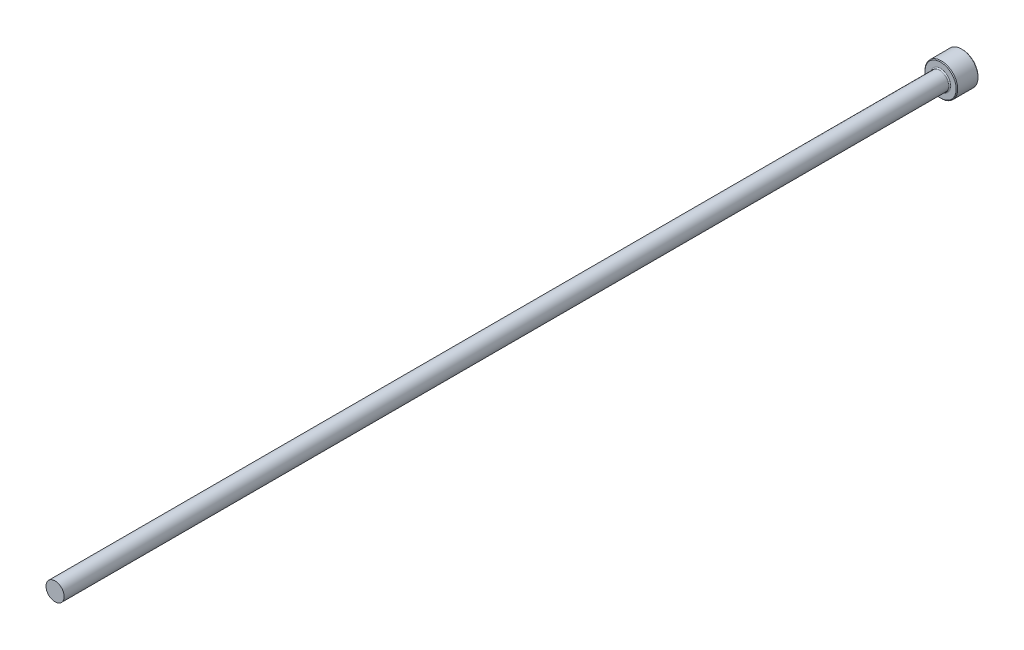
SolidWorks part; units mm, degrees
ref_plane "Front Plane" through (0, 0, 0) normal (0, 0, 1) x (1, 0, 0)
ref_plane "Top Plane" through (0, 0, 0) normal (0, 1, 0) x (1, 0, 0)
ref_plane "Right Plane" through (0, 0, 0) normal (1, 0, 0) x (0, 0, -1)
sketch "Sketch1" plane through (0, 0, 0) normal (1, 0, 0) x (0, 0, -1)
  line L0 (0, 0) -> (0, 4.5)
  line L1 (0, 4.95) -> (0, -4.95) construction
  line L2 (0, 4.5) -> (-6, 4.5)
  line L3 (-6, 4.5) -> (-6, 2.8)
  line L4 (-6.3, 2.5) -> (-250, 2.5)
  line L5 (-250, 2.5) -> (-250, 0)
  line L6 (4.95, 0) -> (-4.95, 0) construction
  line L7 (-250, 0) -> (0, 0)
  line L8 (-109.0506, 0) -> (16.9928, 0) construction
  arc A0 (-6, 2.8) -> (-6.3, 2.5) centre (-6.3, 2.8) cw
  dimension "D1" = 0.3
  dimension "D2" = 9
  dimension "D3" = 5
  dimension "D4" = 250
  dimension "D5" = 6
revolve "Revolve1" add sketch "Sketch1" angle 360 about L8
chamfer "Chamfer1" distance 0.2 angle 45 2 edges at (4.5, 0, 0) (4.5, 0, 6)
